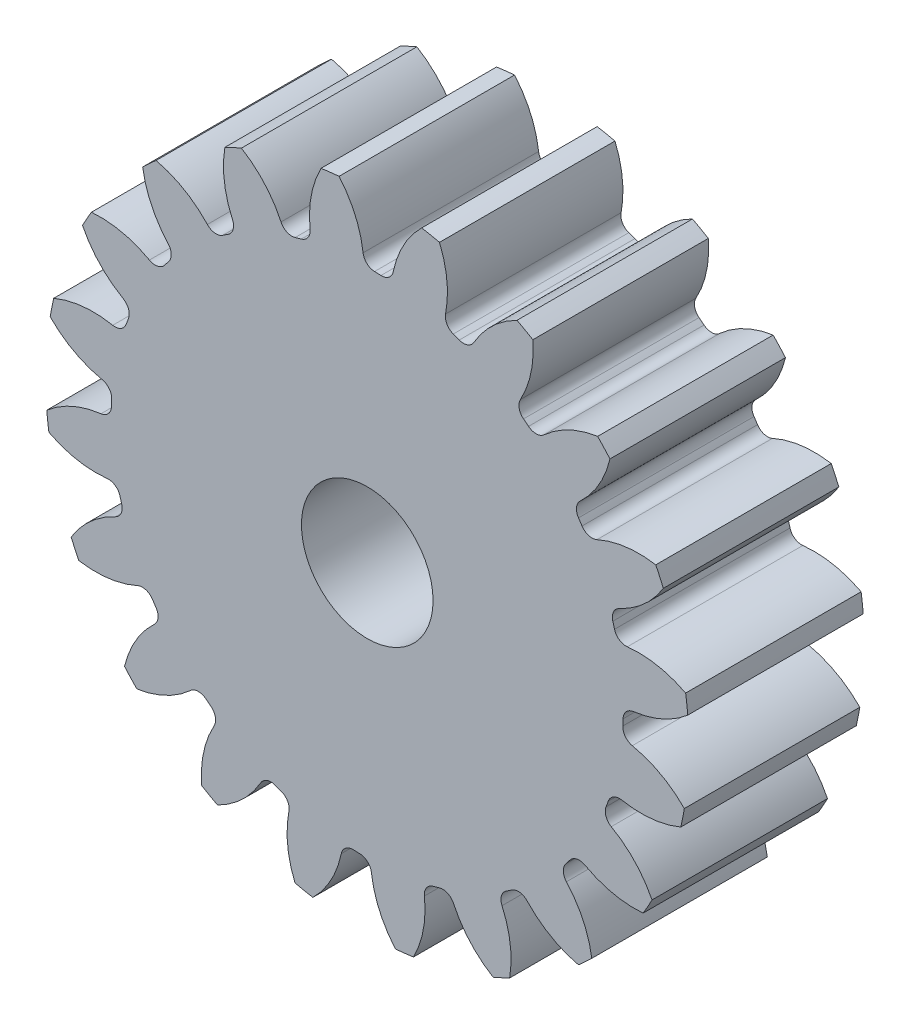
SolidWorks part; units mm, degrees
ref_plane "Front" through (0, 0, 0) normal (0, 0, 1) x (1, 0, 0)
ref_plane "Top" through (0, 0, 0) normal (0, 1, 0) x (1, 0, 0)
ref_plane "Right" through (0, 0, 0) normal (1, 0, 0) x (0, 0, -1)
sketch "Sketch3" plane through (0, 0, 0) normal (0, 0, 1) x (1, 0, 0)
  circle A0 centre (0, 0) radius 186.2667
  dimension "od" = 372.5333
extrude "gearBody" add sketch "Sketch3" along normal blind 101.6
sketch "Sketch2" plane through (0, 0, 0) normal (0, 0, 1) x (1, 0, 0)
  line L0 (0, 0) -> (147.0089, 60.8931) construction
  line L1 (184.2477, -32.1774) -> (0, 0) construction
  line L2 (0, 0) -> (36.3143, 0) construction
  line L3 (169.2156, 6.3129) -> (168.127, -20.1766) construction
  line L5 (168.6713, -6.9319) -> (0, 0) construction
  line L7 (0, 0) -> (159.1213, 0) construction
  arc A0 (159.0887, 3.2198) -> (158.288, -16.263) centre (0, 0) ccw construction
  arc A1 (185.5503, 16.3207) -> (183.5854, -31.491) centre (0, 0) ccw construction
  arc A2 (169.2156, 6.3129) -> (168.127, -20.1766) centre (0, 0) ccw construction
  arc A3 (147.9545, -7.9271) -> (148.106, -4.24) centre (0, 0) ccw
  arc A4 (184.2477, -32.1774) -> (153.4417, -15.0451) centre (141.5166, -72.7506) ccw
  arc A5 (184.2477, -32.1774) -> (186.2667, 16.9504) centre (0, 0) ccw
  arc A6 (186.2667, 16.9504) -> (154.1588, 2.4037) centre (147.0089, 60.8931) cw
  arc A7 (148.106, -4.24) -> (154.1588, 2.4037) centre (154.995, -4.4373) cw
  arc A8 (153.4417, -15.0451) -> (147.9545, -7.9271) centre (154.8365, -8.2958) cw
  point P6 (186.2667, 16.9504)
  point P22 (184.2477, -32.1774)
  dimension "baseDia" = 318.2426
  dimension "od" = 372.5333
  dimension "pd" = 338.6667
  dimension "rd" = 296.3333
  dimension "rFillet" = 6.8919
  dimension "pointX" = 186.2667
  dimension "pointY" = 16.9504
  dimension "CTT" = 26.4896
  dimension "flankCenterAngle" = 22.5
extrude "toothCut" cut sketch "Sketch2" along normal through all
pattern_circular "CirPattern1" count 20 over 360 about axis through (0, 0, 0) along (0, 0, 1) of "toothCut"
sketch "hub1Dia" plane through (0, 0, 0) normal (0, 0, -1) x (-1, 0, 0)
  circle A0 centre (0, 0) radius 12.7
  dimension "hub1Dia" = 25.4
sketch "hub2Dia" plane through (0, 0, 101.6) normal (0, 0, 1) x (1, 0, 0)
  circle A0 centre (0, 0) radius 12.7
  dimension "hub2dia" = 25.4
sketch "boreDia" plane through (0, 0, 0) normal (0, 0, 1) x (1, 0, 0)
  circle A0 centre (0, 0) radius 38.1
  dimension "boreDia" = 76.2
extrude "bore" cut sketch "boreDia" against normal mid plane 25400
